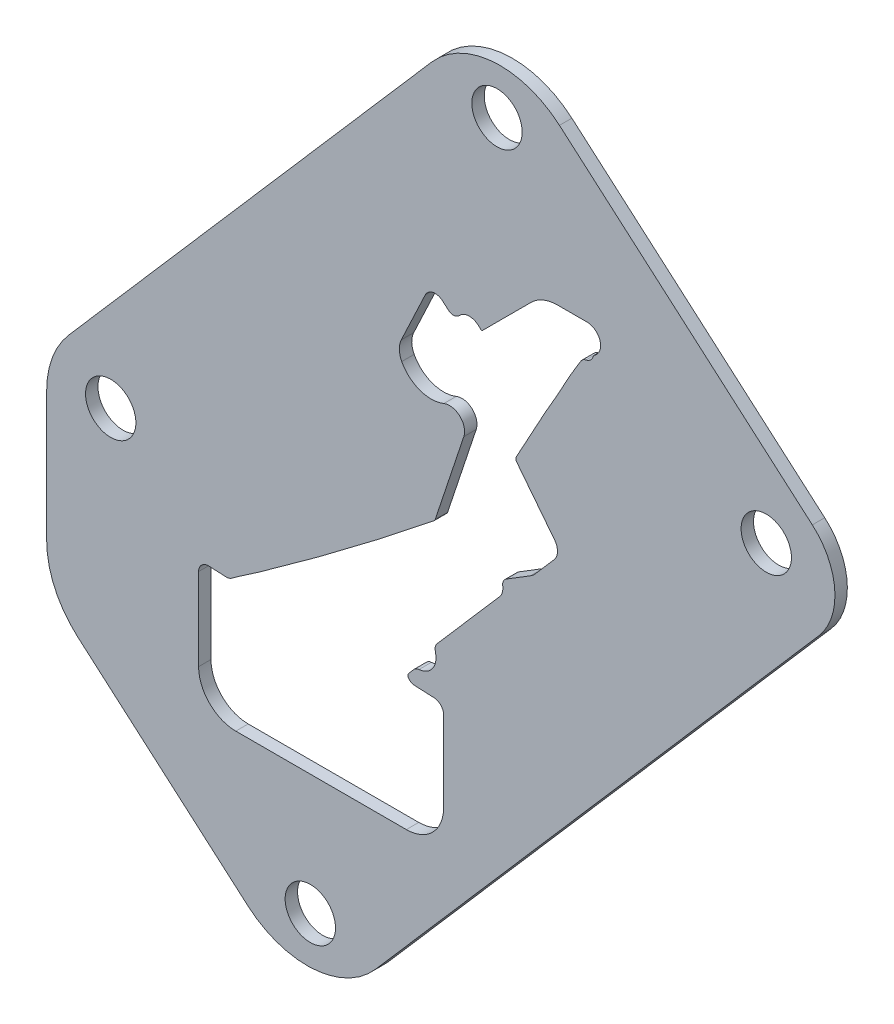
SolidWorks part; units mm, degrees
ref_plane "Front" through (0, 0, 0) normal (0, 0, 1) x (1, 0, 0)
ref_plane "Top" through (0, 0, 0) normal (0, 1, 0) x (1, 0, 0)
ref_plane "Right" through (0, 0, 0) normal (1, 0, 0) x (0, 0, -1)
ref_plane "Plane1"
sketch "Sketch1" plane through (0, 0, -29.21) normal (0, 0, 1) x (1, 0, 0)
  line L4 (-277.3377, -5.7393) -> (-329.1177, 39.2279)
  line L5 (-355.9919, 37.3355) -> (-430.3083, -48.2402)
  line L6 (-428.4159, -101.6157) -> (-393.5913, -131.8583)
  line L7 (-366.7171, -129.9659) -> (-275.9499, -25.4471)
  line L8 (-277.3377, -5.7393) -> (-329.1177, 39.2279)
  line L9 (-355.9919, 37.3355) -> (-430.3083, -48.2402)
  line L10 (-428.4159, -101.6157) -> (-393.5913, -131.8583)
  line L11 (-366.7171, -129.9659) -> (-275.9499, -25.4471)
  line L66 (-434.975, -60.7311) -> (-434.975, -87.2323)
  line L67 (-434.975, -60.7311) -> (-434.975, -87.2323)
  arc A4 (-329.1177, 39.2279) -> (-355.9919, 37.3355) centre (-341.6086, 24.8446) ccw
  arc A5 (-434.975, -87.2323) -> (-428.4159, -101.6157) centre (-415.925, -87.2323) ccw
  arc A6 (-393.5913, -131.8583) -> (-366.7171, -129.9659) centre (-381.1005, -117.475) ccw
  arc A7 (-275.9499, -25.4471) -> (-277.3377, -5.7393) centre (-286.4977, -16.2871) ccw
  arc A8 (-329.1177, 39.2279) -> (-355.9919, 37.3355) centre (-341.6086, 24.8446) ccw
  arc A9 (-434.975, -87.2323) -> (-428.4159, -101.6157) centre (-415.925, -87.2323) ccw
  arc A10 (-393.5913, -131.8583) -> (-366.7171, -129.9659) centre (-381.1005, -117.475) ccw
  arc A11 (-275.9499, -25.4471) -> (-277.3377, -5.7393) centre (-286.4977, -16.2871) ccw
  arc A70 (-430.3083, -48.2402) -> (-434.975, -60.7311) centre (-415.925, -60.7311) ccw
  arc A71 (-430.3083, -48.2402) -> (-434.975, -60.7311) centre (-415.925, -60.7311) ccw
sketch "Sketch2" plane through (0, 0, -29.21) normal (0, 0, 1) x (1, 0, 0)
  line L4 (-277.6708, -6.1229) -> (-329.4508, 38.8444)
  line L5 (-355.6084, 37.0024) -> (-429.9248, -48.5733)
  line L6 (-428.0828, -101.2321) -> (-393.2583, -131.4748)
  line L7 (-367.1007, -129.6328) -> (-276.3335, -25.114)
  line L8 (-277.6708, -6.1229) -> (-329.4508, 38.8444)
  line L9 (-355.6084, 37.0024) -> (-429.9248, -48.5733)
  line L10 (-428.0828, -101.2321) -> (-393.2583, -131.4748)
  line L11 (-367.1007, -129.6328) -> (-276.3335, -25.114)
  line L13 (-434.467, -60.7311) -> (-434.467, -87.2323)
  line L14 (-434.467, -60.7311) -> (-434.467, -87.2323)
  arc A4 (-329.4508, 38.8444) -> (-355.6084, 37.0024) centre (-341.6086, 24.8446) ccw
  arc A5 (-434.467, -87.2323) -> (-428.0828, -101.2321) centre (-415.925, -87.2323) ccw
  arc A6 (-393.2583, -131.4748) -> (-367.1007, -129.6328) centre (-381.1005, -117.475) ccw
  arc A7 (-276.3335, -25.114) -> (-277.6708, -6.1229) centre (-286.4977, -16.2871) ccw
  arc A8 (-329.4508, 38.8444) -> (-355.6084, 37.0024) centre (-341.6086, 24.8446) ccw
  arc A9 (-434.467, -87.2323) -> (-428.0828, -101.2321) centre (-415.925, -87.2323) ccw
  arc A10 (-393.2583, -131.4748) -> (-367.1007, -129.6328) centre (-381.1005, -117.475) ccw
  arc A11 (-276.3335, -25.114) -> (-277.6708, -6.1229) centre (-286.4977, -16.2871) ccw
  arc A13 (-429.9248, -48.5733) -> (-434.467, -60.7311) centre (-415.925, -60.7311) ccw
  arc A14 (-429.9248, -48.5733) -> (-434.467, -60.7311) centre (-415.925, -60.7311) ccw
extrude "Boss-Extrude1" add sketch "Sketch2" against normal blind 2.54 flip side to cut
hole_wizard "Hole1" positions "Point_Sketch" profile "Profil_Sketch" hole size "Ø0.15" standard "ISO"
sketch "Point_Sketch" plane through (-324.5757, -14.4605, -29.21) normal (0, 0, -1) x (1, 0, 0)
  point P0 (-17.6637, -48.2631)
  point P2 (37.4724, -0.3814)
  point P4 (-55.8939, 111.9726)
  point P6 (-96.7727, 42.8312)
sketch "Profil_Sketch" plane through (-342.2394, 33.8027, -29.21) normal (1, 0, 0) x (0, -1, 0)
  line L0 (0, 0) -> (0, 2.54)
  line L1 (0, 2.54) -> (5.1562, 2.54)
  line L2 (5.1562, 2.54) -> (5.1562, 0)
  line L5 (5.1562, 0) -> (0, 0)
  line L11 (0, -6.35) -> (0, 107.95) construction
  dimension "Diameter" = 10.3124
  dimension "Thru Hole Depth" = 2.54
other "usin_DL090_.375-16x1.75-SHCS<1>"
ref_plane "Plane1 QU250515L_Punch26[Mounted in the strip]-1"
sketch "Sketch1 QU250515L_Punch26[Mounted in the strip]-1" plane through (0, 0, -29.21) normal (0, 0, 1) x (1, 0, 0)
  line L23 (-323.8215, 6.7788) -> (-329.8669, 6.7788)
  line L24 (-329.8845, -9.2046) -> (-327.7103, -5.2249)
  line L25 (-332.4669, -13.7015) -> (-329.8845, -9.2046)
  line L26 (-338.3114, -24.3991) -> (-332.4669, -13.7015)
  line L27 (-330.4504, -35.1663) -> (-338.2458, -25.1988)
  line L28 (-334.3982, -43.1602) -> (-330.5417, -38.7195)
  line L29 (-341.3852, -47.7089) -> (-335.4203, -44.0286)
  line L30 (-355.1111, -66.3021) -> (-341.7241, -50.8869)
  line L31 (-354.7654, -67.8312) -> (-354.8224, -67.3599)
  line L32 (-360.8031, -74.3282) -> (-358.8174, -72.0416)
  line L33 (-359.69, -75.2948) -> (-360.8031, -74.3282)
  line L34 (-355.1233, -75.51) -> (-359.69, -75.2948)
  line L35 (-353.187, -94.107) -> (-353.187, -77.5397)
  line L36 (-395.732, -101.727) -> (-360.807, -101.727)
  line L37 (-403.352, -77.2405) -> (-403.352, -94.107)
  line L38 (-397.7194, -75.3759) -> (-401.2243, -75.2107)
  line L39 (-390.9176, -71.1107) -> (-394.7939, -73.7632)
  line L40 (-349.0383, -26.1524) -> (-354.893, -43.7615)
  line L41 (-356.9494, -4.996) -> (-361.8376, -15.3843)
  line L42 (-350.6737, -6.6223) -> (-353.407, -4.2486)
  line L43 (-345.5748, -5.4136) -> (-345.934, -5.0544)
  line L44 (-335.255, 4.5469) -> (-345.2156, -5.4136)
  line L45 (-323.8215, 6.7788) -> (-329.8669, 6.7788)
  line L46 (-329.8845, -9.2046) -> (-327.7103, -5.2249)
  line L47 (-332.4669, -13.7015) -> (-329.8845, -9.2046)
  line L48 (-338.3114, -24.3991) -> (-332.4669, -13.7015)
  line L49 (-330.4504, -35.1663) -> (-338.2458, -25.1988)
  line L50 (-334.3982, -43.1602) -> (-330.5417, -38.7195)
  line L51 (-341.3852, -47.7089) -> (-335.4203, -44.0286)
  line L52 (-355.1111, -66.3021) -> (-341.7241, -50.8869)
  line L53 (-354.7654, -67.8312) -> (-354.8224, -67.3599)
  line L54 (-360.8031, -74.3282) -> (-358.8174, -72.0416)
  line L55 (-359.69, -75.2948) -> (-360.8031, -74.3282)
  line L56 (-355.1233, -75.51) -> (-359.69, -75.2948)
  line L57 (-353.187, -94.107) -> (-353.187, -77.5397)
  line L58 (-395.732, -101.727) -> (-360.807, -101.727)
  line L59 (-403.352, -77.2405) -> (-403.352, -94.107)
  line L60 (-397.7194, -75.3759) -> (-401.2243, -75.2107)
  line L61 (-390.9176, -71.1107) -> (-394.7939, -73.7632)
  line L62 (-349.0383, -26.1524) -> (-354.893, -43.7615)
  line L63 (-356.9494, -4.996) -> (-361.8376, -15.3843)
  line L64 (-350.6737, -6.6223) -> (-353.407, -4.2486)
  line L65 (-345.5748, -5.4136) -> (-345.934, -5.0544)
  line L66 (-335.255, 4.5469) -> (-345.2156, -5.4136)
  arc A36 (-322.3655, 1.6001) -> (-323.8215, 6.7788) centre (-323.8215, 3.9848) ccw
  arc A37 (-322.3655, 1.6001) -> (-322.465, 1.4871) centre (-322.2331, 1.3833) ccw
  arc A38 (-322.465, 1.4871) -> (-322.6655, 1.0335) centre (-274.8211, -19.8428) ccw
  arc A39 (-324.5086, -0.0766) -> (-322.6655, 1.0335) centre (-324.369, 1.7768) ccw
  arc A40 (-324.5086, -0.0766) -> (-324.6362, -0.0921) centre (-324.5334, -0.4056) ccw
  arc A41 (-324.6362, -0.0921) -> (-326.8439, -3.7238) centre (-213.8052, -69.9538) ccw
  arc A42 (-326.8439, -3.7238) -> (-327.2855, -4.4684) centre (-295.3841, -22.8808) ccw
  arc A43 (-327.2855, -4.4684) -> (-327.7103, -5.2249) centre (-246.2982, -50.4461) ccw
  arc A44 (-338.3114, -24.3991) -> (-338.2458, -25.1988) centre (-337.6707, -24.7491) ccw
  arc A45 (-330.5417, -38.7195) -> (-330.4504, -35.1663) centre (-332.6513, -36.8875) ccw
  arc A46 (-335.4203, -44.0286) -> (-334.3982, -43.1602) centre (-337.7543, -40.2457) ccw
  arc A47 (-341.7241, -50.8869) -> (-341.3852, -47.7089) centre (-343.8336, -49.0549) ccw
  arc A48 (-354.8224, -67.3599) -> (-355.1111, -66.3021) centre (-358.5651, -67.813) ccw
  arc A49 (-358.8174, -72.0416) -> (-354.7654, -67.8312) centre (-358.5081, -68.2843) ccw
  arc A50 (-353.187, -77.5397) -> (-355.1233, -75.51) centre (-355.219, -77.5397) ccw
  arc A51 (-360.807, -101.727) -> (-353.187, -94.107) centre (-360.807, -94.107) ccw
  arc A52 (-403.352, -94.107) -> (-395.732, -101.727) centre (-395.732, -94.107) ccw
  arc A53 (-401.2243, -75.2107) -> (-403.352, -77.2405) centre (-401.32, -77.2405) ccw
  arc A54 (-397.7194, -75.3759) -> (-396.6035, -75.0476) centre (-397.6357, -73.5999) ccw
  arc A55 (-394.7939, -73.7632) -> (-396.6035, -75.0476) centre (-95.1891, -497.8086) ccw
  arc A56 (-390.9176, -71.1107) -> (-355.1275, -44.0994) centre (-793.7243, 499.8274) ccw
  arc A57 (-355.1275, -44.0994) -> (-354.893, -43.7615) centre (-355.5857, -43.5312) ccw
  arc A58 (-349.0383, -26.1524) -> (-353.1242, -22.3287) centre (-351.961, -25.1806) ccw
  arc A59 (-361.7483, -19.1959) -> (-353.1242, -22.3287) centre (-355.7059, -15.999) ccw
  arc A60 (-361.8376, -15.3843) -> (-361.7483, -19.1959) centre (-357.9773, -17.2007) ccw
  arc A61 (-353.407, -4.2486) -> (-356.9494, -4.996) centre (-354.8954, -5.9625) ccw
  arc A62 (-345.934, -5.0544) -> (-350.6737, -6.6223) centre (-347.9097, -7.0301) ccw
  arc A63 (-345.5748, -5.4136) -> (-345.2156, -5.4136) centre (-345.3952, -5.234) ccw
  arc A64 (-329.8669, 6.7788) -> (-335.255, 4.5469) centre (-329.8669, -0.8412) ccw
  arc A65 (-322.3655, 1.6001) -> (-323.8215, 6.7788) centre (-323.8215, 3.9848) ccw
  arc A66 (-322.3655, 1.6001) -> (-322.465, 1.4871) centre (-322.2331, 1.3833) ccw
  arc A67 (-322.465, 1.4871) -> (-322.6655, 1.0335) centre (-274.8211, -19.8428) ccw
  arc A68 (-324.5086, -0.0766) -> (-322.6655, 1.0335) centre (-324.369, 1.7768) ccw
  arc A69 (-324.5086, -0.0766) -> (-324.6362, -0.0921) centre (-324.5334, -0.4056) ccw
  arc A70 (-324.6362, -0.0921) -> (-326.8439, -3.7238) centre (-213.8052, -69.9538) ccw
  arc A71 (-326.8439, -3.7238) -> (-327.2855, -4.4684) centre (-295.3841, -22.8808) ccw
  arc A72 (-327.2855, -4.4684) -> (-327.7103, -5.2249) centre (-246.2982, -50.4461) ccw
  arc A73 (-338.3114, -24.3991) -> (-338.2458, -25.1988) centre (-337.6707, -24.7491) ccw
  arc A74 (-330.5417, -38.7195) -> (-330.4504, -35.1663) centre (-332.6513, -36.8875) ccw
  arc A75 (-335.4203, -44.0286) -> (-334.3982, -43.1602) centre (-337.7543, -40.2457) ccw
  arc A76 (-341.7241, -50.8869) -> (-341.3852, -47.7089) centre (-343.8336, -49.0549) ccw
  arc A77 (-354.8224, -67.3599) -> (-355.1111, -66.3021) centre (-358.5651, -67.813) ccw
  arc A78 (-358.8174, -72.0416) -> (-354.7654, -67.8312) centre (-358.5081, -68.2843) ccw
  arc A79 (-353.187, -77.5397) -> (-355.1233, -75.51) centre (-355.219, -77.5397) ccw
  arc A80 (-360.807, -101.727) -> (-353.187, -94.107) centre (-360.807, -94.107) ccw
  arc A81 (-403.352, -94.107) -> (-395.732, -101.727) centre (-395.732, -94.107) ccw
  arc A82 (-401.2243, -75.2107) -> (-403.352, -77.2405) centre (-401.32, -77.2405) ccw
  arc A83 (-397.7194, -75.3759) -> (-396.6035, -75.0476) centre (-397.6357, -73.5999) ccw
  arc A84 (-394.7939, -73.7632) -> (-396.6035, -75.0476) centre (-95.1891, -497.8086) ccw
  arc A85 (-390.9176, -71.1107) -> (-355.1275, -44.0994) centre (-793.7243, 499.8274) ccw
  arc A86 (-355.1275, -44.0994) -> (-354.893, -43.7615) centre (-355.5857, -43.5312) ccw
  arc A87 (-349.0383, -26.1524) -> (-353.1242, -22.3287) centre (-351.961, -25.1806) ccw
  arc A88 (-361.7483, -19.1959) -> (-353.1242, -22.3287) centre (-355.7059, -15.999) ccw
  arc A89 (-361.8376, -15.3843) -> (-361.7483, -19.1959) centre (-357.9773, -17.2007) ccw
  arc A90 (-353.407, -4.2486) -> (-356.9494, -4.996) centre (-354.8954, -5.9625) ccw
  arc A91 (-345.934, -5.0544) -> (-350.6737, -6.6223) centre (-347.9097, -7.0301) ccw
  arc A92 (-345.5748, -5.4136) -> (-345.2156, -5.4136) centre (-345.3952, -5.234) ccw
  arc A93 (-329.8669, 6.7788) -> (-335.255, 4.5469) centre (-329.8669, -0.8412) ccw
extrude "Cut-Extrude1 QU250515L_Punch26[Mounted in the strip]-1" cut sketch "Sketch1 QU250515L_Punch26[Mounted in the strip]-1" against normal through all
fillet "Fillet1" radius 1.5875 6 edges at (-355.1111, -66.3021, -30.48) (-324.6362, -0.0921, -30.48) (-350.6737, -6.6223, -30.48) (-341.3852, -47.7089, -30.48) (-358.8174, -72.0416, -30.48) (-359.69, -75.2948, -30.48)
fillet "Fillet2" radius 0.7937 1 edges at (-360.8031, -74.3282, -30.48)
